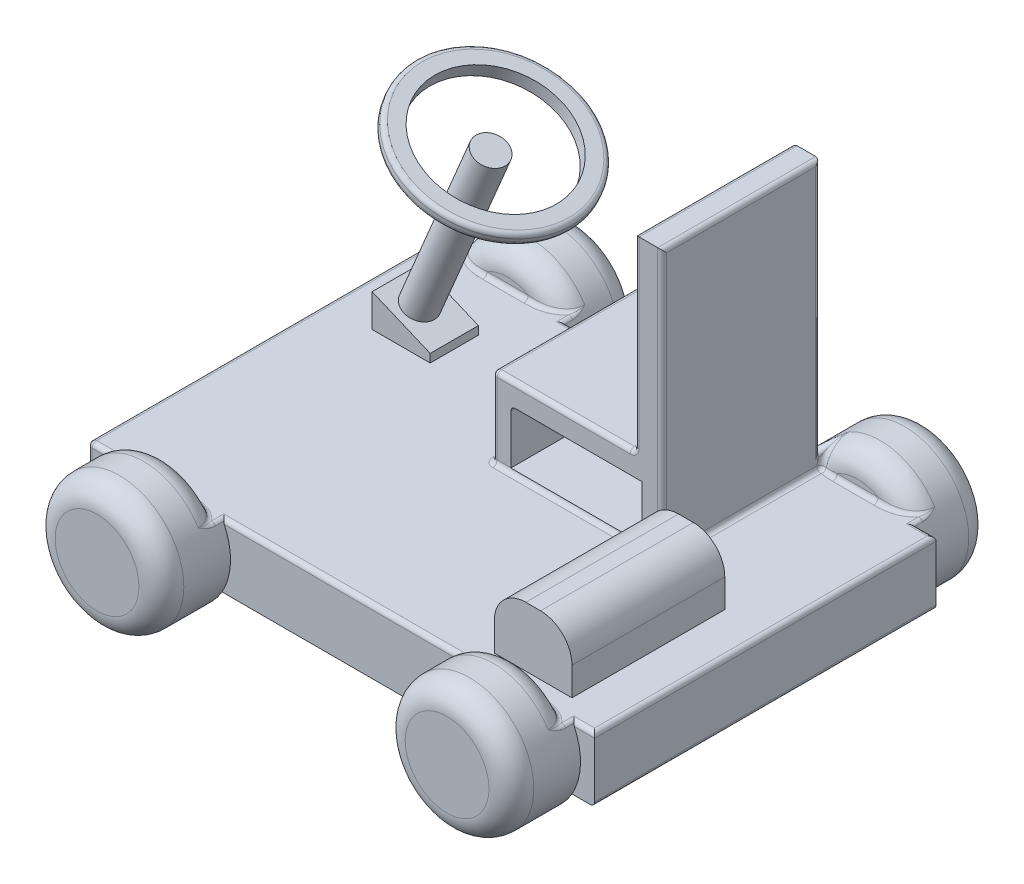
SolidWorks part; units mm, degrees
ref_plane "Front Plane" through (0, 0, 0) normal (0, 0, 1) x (1, 0, 0)
ref_plane "Top Plane" through (0, 0, 0) normal (0, 1, 0) x (1, 0, 0)
ref_plane "Right Plane" through (0, 0, 0) normal (1, 0, 0) x (0, 0, -1)
sketch "Sketch1" plane through (0, 0, 0) normal (0, 0, 1) x (1, 0, 0)
  line L1 (-143.4335, 18.1113) -> (143.4335, 18.1113)
  line L2 (-143.4335, 18.1113) -> (-143.4335, -18.1113)
  line L3 (-143.4335, -18.1113) -> (143.4335, -18.1113)
  line L4 (143.4335, 18.1113) -> (143.4335, -18.1113)
  line L5 (-143.4335, 18.1113) -> (143.4335, -18.1113) construction
  line L6 (-143.4335, -18.1113) -> (143.4335, 18.1113) construction
  point P0 (0, 0)
extrude "Boss-Extrude1" add sketch "Sketch1" along normal mid plane 193.294
sketch "Sketch2" plane through (0, 0, 96.647) normal (0, 0, 1) x (1, 0, 0)
  line L0 (0, 0) -> (0, 94.2831) construction
  circle A0 centre (-99.0329, 0) radius 36.3916
  circle A1 centre (99.0329, 0) radius 36.3916
extrude "Boss-Extrude2" add sketch "Sketch2" along normal blind 39.116
mirror "Mirror1" about plane through (0, 0, 0) normal (0, 0, 1) of "Boss-Extrude2"
sketch "Sketch3" plane through (0, 18.1113, 0) normal (0, 1, 0) x (1, 0, 0)
  line L1 (-117.3592, 65.4882) -> (-84.4931, 65.4882)
  line L2 (-117.3592, 65.4882) -> (-117.3592, 38.2334)
  line L3 (-117.3592, 38.2334) -> (-84.4931, 38.2334)
  line L4 (-84.4931, 65.4882) -> (-84.4931, 38.2334)
  line L5 (-117.3592, 65.4882) -> (-84.4931, 38.2334) construction
  line L6 (-117.3592, 38.2334) -> (-84.4931, 65.4882) construction
  point P0 (-100.9262, 51.8608)
extrude "Boss-Extrude3" add sketch "Sketch3" along normal blind 18.542
sketch "Sketch4" plane through (0, 0, -38.2334) normal (0, 0, 1) x (1, 0, 0)
  line L0 (-117.3592, 36.6533) -> (-84.4931, 36.6533)
  line L1 (-84.4931, 36.6533) -> (-84.4931, 22.8344)
  line L2 (-84.4931, 22.8344) -> (-117.3592, 36.6533)
extrude "Cut-Extrude1" cut sketch "Sketch4" against normal up to surface (27.2548 mm away)
sketch "Sketch5" plane through (-4.5347, -10.7851, 0) normal (0.3876, 0.9218, 0) x (0.9218, -0.3876, 0)
  circle A0 centre (-107.4294, 51.4244) radius 8.9299
extrude "Boss-Extrude4" add sketch "Sketch5" along normal blind 103.378
sketch "Sketch6" plane through (35.534, 84.5119, 0) normal (0.3876, 0.9218, 0) x (0.9218, -0.3876, 0)
  circle A0 centre (-107.4294, 51.4244) radius 47.5751
  circle A1 centre (-107.4294, 51.4244) radius 37.2867
extrude "Boss-Extrude5" add sketch "Sketch6" along normal blind 7.366 separate body
sketch "Sketch7" plane through (0, 18.1113, 0) normal (0, 1, 0) x (1, 0, 0)
  line L1 (75.7875, 0.7396) -> (119.6998, 0.7396)
  line L2 (75.7875, 0.7396) -> (75.7875, -85.7543)
  line L3 (75.7875, -85.7543) -> (119.6998, -85.7543)
  line L4 (119.6998, 0.7396) -> (119.6998, -85.7543)
  line L5 (75.7875, 0.7396) -> (119.6998, -85.7543) construction
  line L6 (75.7875, -85.7543) -> (119.6998, 0.7396) construction
  point P0 (97.7437, -42.5074)
extrude "Boss-Extrude6" add sketch "Sketch7" along normal blind 33.782
sketch "Sketch8" plane through (0, 18.1113, 0) normal (0, 1, 0) x (1, 0, 0)
  line L0 (67.4682, 96.647) -> (130.5975, 96.647) construction
  line L1 (-18.133, 7.2334) -> (77.7566, 7.2334)
  line L2 (-18.133, 7.2334) -> (-18.133, 96.647)
  line L3 (-18.133, 96.647) -> (77.7566, 96.647)
  line L4 (77.7566, 7.2334) -> (77.7566, 96.647)
  line L5 (-18.133, 7.2334) -> (77.7566, 96.647) construction
  line L6 (-18.133, 96.647) -> (77.7566, 7.2334) construction
  point P0 (29.8118, 51.9402)
extrude "Boss-Extrude7" add sketch "Sketch8" along normal blind 45.466
sketch "Sketch9" plane through (0, 63.5773, 0) normal (0, 1, 0) x (1, 0, 0)
  line L0 (-18.133, 7.2334) -> (77.7566, 7.2334) construction
  line L1 (77.7566, 96.647) -> (62.2013, 96.647)
  line L2 (77.7566, 96.647) -> (77.7566, 7.2334)
  line L3 (77.7566, 7.2334) -> (62.2013, 7.2334)
  line L4 (62.2013, 96.647) -> (62.2013, 7.2334)
extrude "Boss-Extrude8" add sketch "Sketch9" along normal blind 106.426
fillet "Fillet1" radius 12.7 9 edges at (-99.0329, 36.3916, 96.647) (-62.6412, 0, 135.763) (99.0329, 36.3916, 96.647) (62.6412, 0, 135.763) (-62.6412, 0, -135.763) (-99.0329, 36.3916, -96.647) (106.7157, 35.5714, -96.647) (62.6412, 0, -135.763) (77.7566, 23.8177, -96.647)
fillet "Fillet2" radius 2.54 2 edges at (-107.3537, 144.5908, -51.4244) (-104.4987, 151.381, -51.4244)
sketch "Sketch10" plane through (0, 0, -96.647) normal (0, 0, -1) x (-1, 0, 0)
  line L1 (-66.2594, 50.8941) -> (7.8371, 50.8941)
  line L2 (-66.2594, 50.8941) -> (-66.2594, 20.4955)
  line L3 (-66.2594, 20.4955) -> (7.8371, 20.4955)
  line L4 (7.8371, 50.8941) -> (7.8371, 20.4955)
extrude "Cut-Extrude2" cut sketch "Sketch10" against normal through all
fillet "Fillet3" radius 2.54 50 edges at (-18.133, 40.8443, -96.647) (77.7566, 94.0573, -7.2334) (77.7566, 170.0033, -51.9402) (77.7566, 99.7637, -96.647) (77.7566, 29.5241, -102.997) (77.7566, 27.1855, -102.7133) (22.0342, 63.5773, -7.2334) (-18.133, 63.5773, -51.9402) (22.0342, 63.5773, -96.647) (-143.4335, 0, 96.647) (-143.4335, -18.1113, 0) (-143.4335, 0, -96.647) (99.0329, 18.1113, -96.647) (128.093, 18.1113, -102.2773) (130.5975, 18.1113, -102.997) (137.0155, 18.1113, -96.647) (143.4335, 18.1113, 0) (137.0155, 18.1113, 96.647) (67.4682, 18.1113, 102.997) (130.5975, 18.1113, 102.997) (69.9727, 18.1113, 102.2773) (126.0864, 18.1113, 100.2526) (99.0329, 18.1113, 96.647) (0, 18.1113, 96.647) (-130.5975, 18.1113, 102.997) (-67.4682, 18.1113, 102.997) (-128.093, 18.1113, 102.2773) (-71.9793, 18.1113, 100.2526) (-99.0329, 18.1113, 96.647) (-137.0155, 18.1113, 96.647) (-143.4335, 18.1113, 0) (-137.0155, 18.1113, -96.647) (-130.5975, 18.1113, -102.997) (-67.4682, 18.1113, -102.997) (-69.9727, 18.1113, -102.2773) (-126.0864, 18.1113, -100.2526) (-99.0329, 18.1113, -96.647) (-42.8006, 18.1113, -96.647) (-18.133, 18.1113, -51.9402) (29.8118, 18.1113, -7.2334) (77.7566, 18.1113, -52.3062) (62.2013, 116.7903, -96.647) (62.2013, 170.0033, -51.9402) (62.2013, 116.7903, -7.2334) (62.2013, 63.5773, -51.9402) (-18.133, 40.8443, -7.2334) (29.2111, 20.4955, -96.647) (-7.8371, 50.8941, -51.9402) (143.4335, -18.1113, 0)
fillet "Fillet4" radius 17.78 2 edges at (75.7875, 51.8933, 42.5074) (119.6998, 51.8933, 42.5074)
